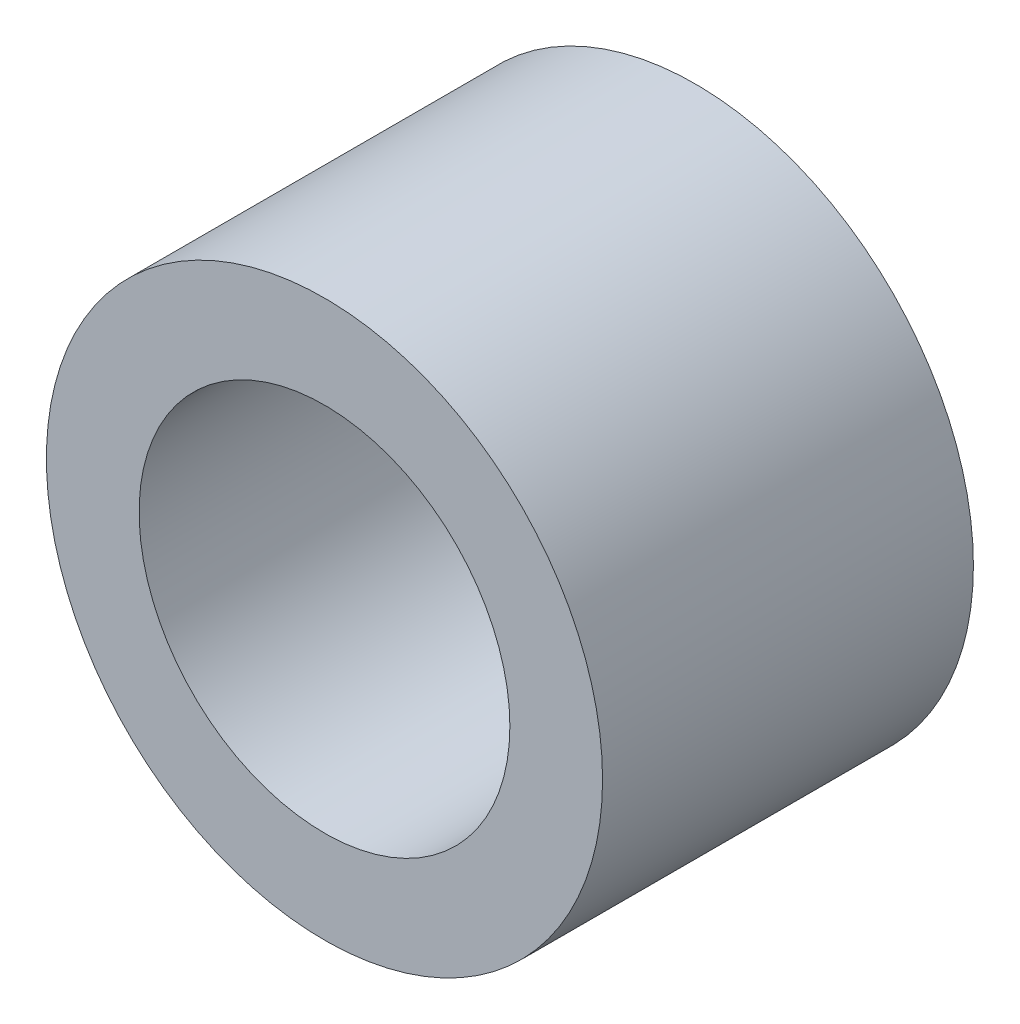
SolidWorks part; units mm, degrees
ref_plane "Přední rovina" through (0, 0, 0) normal (0, 0, 1) x (1, 0, 0)
ref_plane "Horní rovina" through (0, 0, 0) normal (0, 1, 0) x (1, 0, 0)
ref_plane "Pravá rovina" through (0, 0, 0) normal (1, 0, 0) x (0, 0, -1)
sketch "Skica5" plane through (0, 0, 0) normal (0, 0, 1) x (1, 0, 0)
  circle A0 centre (0, 0) radius 25
  circle A1 centre (0, 0) radius 20
  dimension "D1" = 50
  dimension "D2" = 40
extrude "Přidat vysunutím6" add sketch "Skica5" along normal blind 195
sketch "Skica9" plane through (0, 0, 195) normal (0, 0, 1) x (1, 0, 0)
  circle A0 centre (0, 0) radius 15
  circle A1 centre (0, 0) radius 10
  dimension "D1" = 30
  dimension "D2" = 20
extrude "Přidat vysunutím7" add sketch "Skica9" against normal blind 215.0038 separate body
chamfer "Zkosení1" distance 3 angle 45 1 edges at (15, 0, 195)
sketch "Skica10" plane through (0, 0, 195) normal (0, 0, 1) x (1, 0, 0)
  line L0 (0, 0) -> (0, 32.9199)
  line L1 (0, 0) -> (29.3318, -14.9453)
  circle A0 centre (0, 0) radius 32.9199
  dimension "D1" = 117
scale "Měřítko1" [suppressed]
scale "Měřítko2" bodies to scale 114 scale about origin uniform scaling yes scale factor 0.655
extrude "Odebrat vysunutím1" cut sketch "Skica10" against normal blind 190 contours L0 L1 M4 | L1 L0 M4 M3 | L1 A0 L0 M3
sketch "Skica11" plane through (0, 0, 195) normal (0, 0, 1) x (1, 0, 0)
  circle A0 centre (0, 0) radius 29.1985
extrude "Odebrat vysunutím2" cut sketch "Skica11" against normal blind 195
